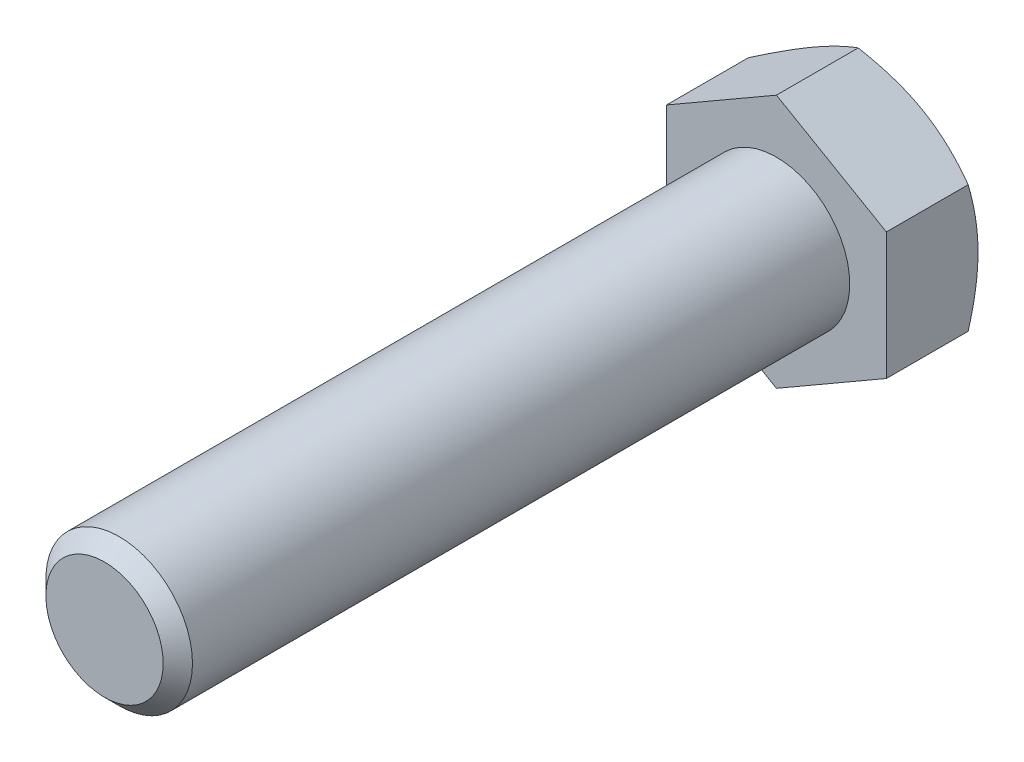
SolidWorks part; units mm, degrees
ref_plane "Plan1" through (0, 0, 0) normal (0, 0, 1) x (1, 0, 0)
ref_plane "Plan2" through (0, 0, 0) normal (0, 1, 0) x (1, 0, 0)
ref_plane "Plan3" through (0, 0, 0) normal (1, 0, 0) x (0, 0, -1)
sketch "Esquisse1" plane through (0, 0, 0) normal (0, 1, 0) x (1, 0, 0)
  line L1 (0, 0) -> (0, -55) construction
  line L2 (0, 0) -> (6, 0)
  line L3 (0, 0) -> (0, -55)
  line L4 (0, -55) -> (6, -55)
  line L6 (6, 0) -> (6, -55)
  dimension "D1" = 55
  dimension "D2" = 6
revolve "Base-Révolution" add sketch "Esquisse1" angle 360 about L1
chamfer "Chanfrein1" distance 1.2 angle 45 1 edges at (6, 0, 55)
sketch "Esquisse6" plane through (0, 0, 0) normal (0, 0, 1) x (1, 0, 0)
  line L0 (0, 0) -> (9, 0) construction
  line L1 (9, -5.1962) -> (9, 5.1962)
  line L2 (0, 0) -> (9, 5.1962) construction
  line L3 (0, 10.3923) -> (9, 5.1962)
  line L4 (0, -10.3923) -> (9, -5.1962)
  line L5 (0, 0) -> (0, 9) construction
  line L6 (-9, -5.1962) -> (-9, 5.1962)
  line L7 (-9, 5.1962) -> (0, 10.3923)
  line L8 (0, -10.3923) -> (-9, -5.1962)
  circle A0 centre (0, 0) radius 9 construction
  dimension "D2" = 30
  dimension "D1" = 18
extrude "Boss.-Extru.1" add sketch "Esquisse6" against normal blind 7.5
sketch "Esquisse7" plane through (0, 0, 0) normal (0, 1, 0) x (1, 0, 0)
  line L0 (-9, 7.5) -> (-21.9904, 7.5)
  line L1 (-9, 7.5) -> (-21.9904, 0)
  line L2 (-21.9904, 7.5) -> (-21.9904, 0)
  line L3 (0, 6.2394) -> (0, 0) construction
  line L4 (0, -53.8) -> (0, -55) construction
  dimension "D1" = 30
revolve "Enlèvement de matière-Révolution1" cut sketch "Esquisse7" angle 360 about L3
equation "\"D1@Chanfrein1\"=\"D2@Esquisse1\"*0.2"
equation "\"D2@Représentation de filetage1\"=\"D2@Esquisse1\"*1.6"
